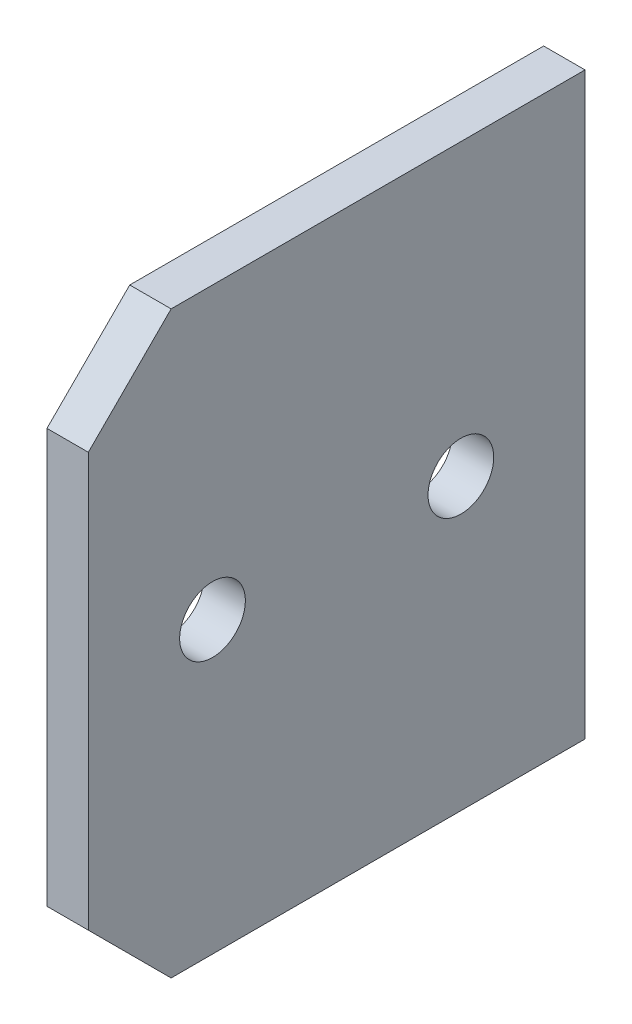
SolidWorks part; units mm, degrees
ref_plane "FRONT" through (0, 0, 0) normal (0, 0, 1) x (1, 0, 0)
ref_plane "TOP" through (0, 0, 0) normal (0, 1, 0) x (1, 0, 0)
ref_plane "RT-SIDE" through (0, 0, 0) normal (1, 0, 0) x (0, 0, -1)
sketch "Sketch1" plane through (0, 0, 0) normal (0, 0, 1) x (1, 0, 0)
  line L2 (-3.175, 44.45) -> (3.175, 44.45)
  line L3 (3.175, -44.45) -> (3.175, 44.45)
  line L4 (-3.175, -44.45) -> (3.175, -44.45)
  line L5 (-3.175, -44.45) -> (-3.175, 44.45)
  line L7 (-15.0187, 0) -> (161.2605, 0) construction
  point P14 (-3.175, 0)
  dimension "D1" = 6.35
  dimension "D2" = 44.45
  dimension "D3" = 88.9
extrude "Base-Extrude" add sketch "Sketch1" along normal blind 76.2
sketch "Sketch2" plane through (3.175, 0, 0) normal (1, 0, 0) x (0, 0, -1)
  line L0 (0, 0) -> (-84.7628, 0) construction
  line L2 (0, 63.7576) -> (0, 12.4424) construction
  line L3 (-19.05, 0) -> (-19.05, -45.8083) construction
  circle A0 centre (-19.05, 0) radius 5.0419
  circle A1 centre (-57.15, 0) radius 5.0419
  dimension "D1" = 38.1
  dimension "D2" = 10.0838
  dimension "D3" = 19.05
extrude "Cut-Extrude1" cut sketch "Sketch2" against normal through all
chamfer "Chamfer1" distance 12.7 angle 45 2 edges at (0, 44.45, 76.2) (0, -44.45, 76.2)
sketch "Sketch3" plane through (-3.175, 0, 0) normal (-1, 0, 0) x (0, 0, 1)
  line L0 (0, 0) -> (76.2, 0)
  line L1 (0, 44.45) -> (0, -44.45) construction
  line L2 (76.2, 31.75) -> (76.2, -31.75) construction
